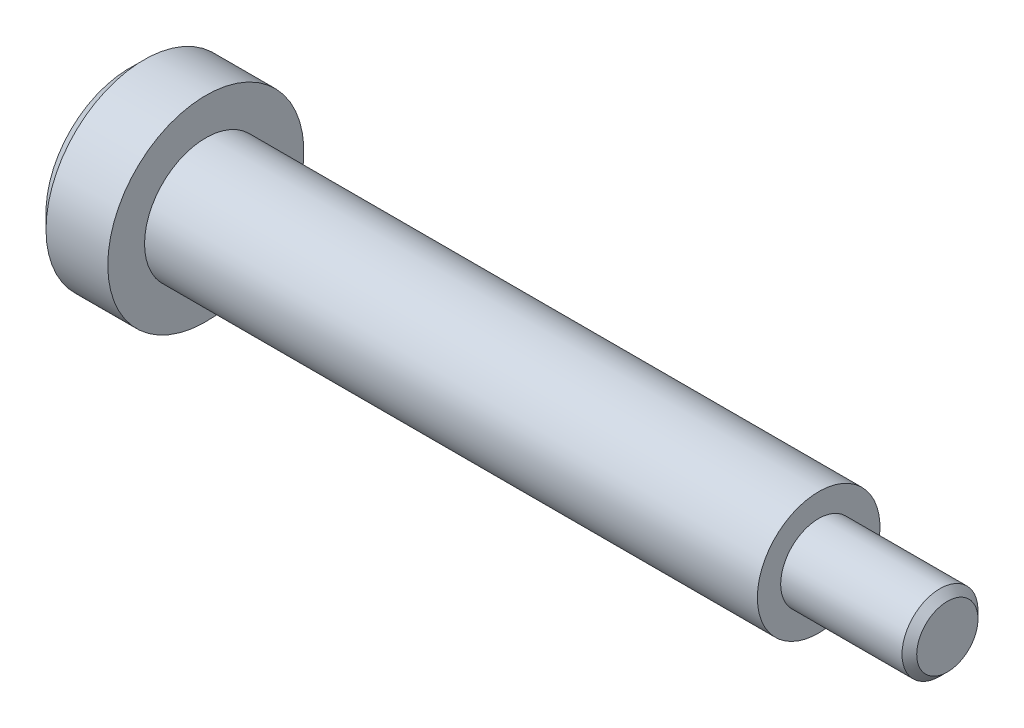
SolidWorks part; units mm, degrees
ref_plane "Front Plane" through (0, 0, 0) normal (0, 0, 1) x (1, 0, 0)
ref_plane "Top Plane" through (0, 0, 0) normal (0, 1, 0) x (1, 0, 0)
ref_plane "Right Plane" through (0, 0, 0) normal (1, 0, 0) x (0, 0, -1)
sketch "Sketch1" plane through (0, 0, 0) normal (0, 0, 1) x (1, 0, 0)
  line L0 (-46.8658, 0) -> (46.6333, 0) construction
  line L1 (-43.6499, 0) -> (-43.6499, 10.16)
  line L2 (-43.6499, 10.16) -> (-35.7251, 10.16)
  line L3 (-35.7251, 10.16) -> (-35.7251, 6.35)
  line L4 (-35.7251, 6.35) -> (27.7749, 6.35)
  line L5 (27.7749, 6.35) -> (27.7749, 3.937)
  line L6 (27.7749, 3.937) -> (41.1099, 3.937)
  line L7 (41.1099, 3.937) -> (41.1099, 0)
  line L8 (41.1099, 0) -> (-43.6499, 0)
  dimension "D1" = 7.874
  dimension "D2" = 12.7
  dimension "D3" = 20.32
  dimension "D4" = 13.335
  dimension "D5" = 43.6499
  dimension "D6" = 7.9248
  dimension "D7" = 63.5
revolve "Revolve1" add sketch "Sketch1" angle 360 about L0
chamfer "Chamfer1" distance 1.524 angle 45 1 edges at (-43.6499, 0, 10.16)
chamfer "Chamfer2" distance 0.762 angle 45 1 edges at (41.1099, 0, 3.937)
